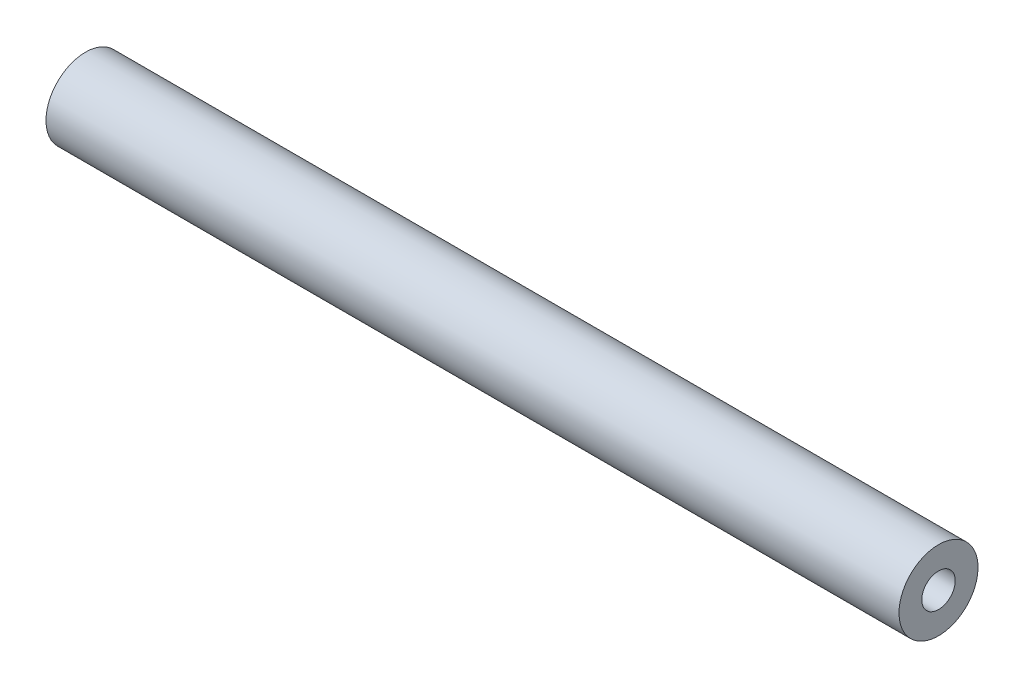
SolidWorks part; units mm, degrees
ref_plane "Front Plane" through (0, 0, 0) normal (0, 0, 1) x (1, 0, 0)
ref_plane "Top Plane" through (0, 0, 0) normal (0, 1, 0) x (1, 0, 0)
ref_plane "Right Plane" through (0, 0, 0) normal (1, 0, 0) x (0, 0, -1)
sketch "Sketch1" plane through (0, 0, 0) normal (0, 0, 1) x (1, 0, 0)
  line L0 (0, 0) -> (0, 7.5)
  line L1 (0, 7.5) -> (161.925, 7.5)
  line L2 (161.925, 7.5) -> (161.925, 0)
  line L3 (161.925, 0) -> (0, 0)
  line L4 (0, 0) -> (-29.1169, 0) construction
  line L5 (0, 3.175) -> (15.24, 3.175)
  line L6 (15.24, 3.175) -> (17.0731, 0)
  line L7 (161.925, 3.175) -> (146.685, 3.175)
  line L8 (146.685, 3.175) -> (144.8519, 0)
  line L9 (80.9625, 7.5) -> (80.9625, 0) construction
  dimension "D1" = 161.925
  dimension "D2" = 15
  dimension "D3" = 6.35
  dimension "D4" = 15.24
  dimension "D5" = 60
sketch "Sketch2" plane through (0, 0, 0) normal (0, 0, 1) x (1, 0, 0)
  line L0 (161.925, 0) -> (0, 0) construction
  line L1 (0, 0) -> (0, 7.5) construction
  line L2 (0, 7.5) -> (161.925, 7.5) construction
  line L3 (161.925, 7.5) -> (161.925, 0) construction
  line L4 (144.8519, 0) -> (17.0731, 0)
  line L5 (0, 3.175) -> (0, 7.5)
  line L6 (0, 7.5) -> (161.925, 7.5)
  line L7 (161.925, 7.5) -> (161.925, 3.175)
  line L8 (15.24, 3.175) -> (17.0731, 0) construction
  line L9 (0, 3.175) -> (15.24, 3.175) construction
  line L10 (146.685, 3.175) -> (144.8519, 0) construction
  line L11 (161.925, 3.175) -> (146.685, 3.175) construction
  line L12 (15.24, 3.175) -> (17.0731, 0)
  line L13 (0, 3.175) -> (15.24, 3.175)
  line L14 (146.685, 3.175) -> (144.8519, 0)
  line L15 (161.925, 3.175) -> (146.685, 3.175)
revolve "Revolve1" add sketch "Sketch2" angle 360 about L4
